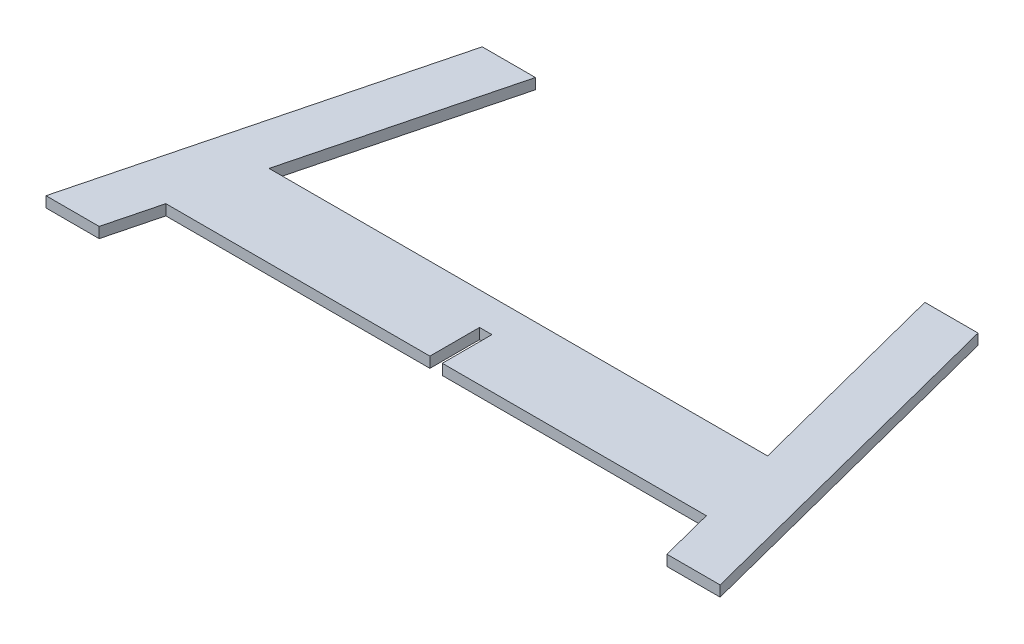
SolidWorks part; units mm, degrees
ref_plane "Front" through (0, 0, 0) normal (0, 0, 1) x (1, 0, 0)
ref_plane "Top" through (0, 0, 0) normal (0, 1, 0) x (1, 0, 0)
ref_plane "Right" through (0, 0, 0) normal (1, 0, 0) x (0, 0, -1)
sketch "Sketch1" plane through (0, 0, 0) normal (0, 1, 0) x (1, 0, 0)
  line L0 (-248.0717, 0) -> (528.634, 0) construction
  line L1 (-5.1315, 180.6904) -> (54.8685, 180.6904)
  line L6 (274.6385, 246.9073) -> (274.6385, -459.5347) construction
  line L7 (0, 246.9073) -> (0, -263.5413) construction
  line L8 (-162.8908, 180.6904) -> (529.9659, 180.6904) construction
  line L9 (-263.8716, -211.0568) -> (477.5293, -211.0568) construction
  line L10 (-5.1315, 180.6904) -> (-105.7999, -211.0568)
  line L11 (-105.7999, -211.0568) -> (-45.7999, -211.0568)
  line L12 (54.8685, 180.6904) -> (-6.5975, -58.5022)
  line L15 (-45.7999, -211.0568) -> (-30.413, -151.1793)
  line L16 (655.0769, -211.0568) -> (595.0769, -211.0568)
  line L17 (595.0769, -211.0568) -> (579.69, -151.1793)
  line L18 (494.4085, 180.6904) -> (555.7941, -58.1891)
  line L19 (554.4085, 180.6904) -> (494.4085, 180.6904)
  line L20 (554.4085, 180.6904) -> (655.0769, -211.0568)
  line L21 (-6.5975, -58.5022) -> (555.7941, -58.1891)
  line L22 (267.6385, -95.1811) -> (267.6385, -151.1811)
  line L24 (281.6385, -151.1793) -> (281.6385, -95.1811)
  line L25 (281.6385, -95.1811) -> (267.6385, -95.1811)
  line L26 (-30.413, -151.1793) -> (267.6385, -151.1811)
  line L27 (281.6385, -151.1793) -> (579.69, -151.1793)
  point P0 (0, 0)
  point P28 (274.6385, -95.1811)
  dimension "D1" = 559.54
  dimension "D2" = 60
  dimension "D3" = 60
  dimension "D5" = 56
  dimension "D6" = 14
extrude "Boss-Extrude1" add sketch "Sketch1" along normal blind 12
